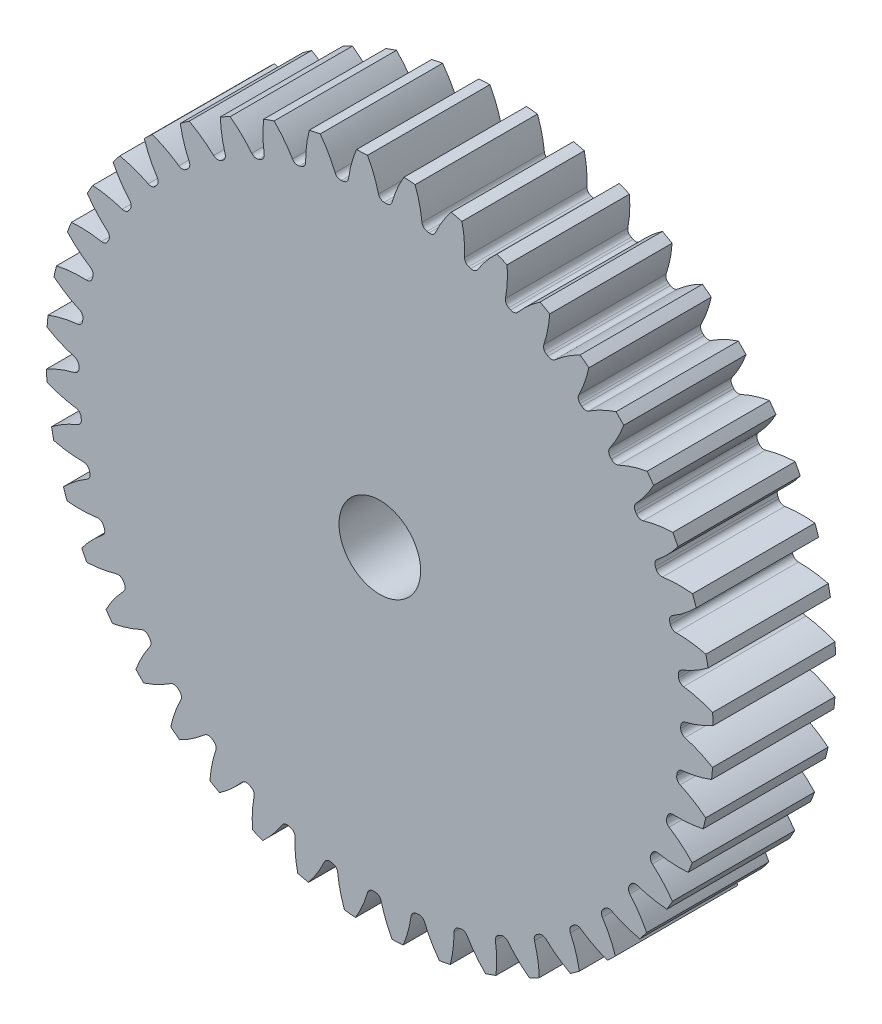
SolidWorks part; units mm, degrees
ref_plane "Front" through (0, 0, 0) normal (0, 0, 1) x (1, 0, 0)
ref_plane "Top" through (0, 0, 0) normal (0, 1, 0) x (1, 0, 0)
ref_plane "Right" through (0, 0, 0) normal (1, 0, 0) x (0, 0, -1)
sketch "Sketch3" plane through (0, 0, 0) normal (0, 0, 1) x (1, 0, 0)
  circle A0 centre (0, 0) radius 259.6444
  dimension "od" = 519.2889
extrude "gearBody" add sketch "Sketch3" along normal blind 95.25
sketch "Sketch2" plane through (0, 0, 0) normal (0, 0, 1) x (1, 0, 0)
  line L0 (0, 0) -> (215.613, 89.3098) construction
  line L1 (259.1306, -18.9688) -> (0, 0) construction
  line L2 (0, 0) -> (36.3143, 0) construction
  line L3 (248.317, 4.3752) -> (248, -13.2845) construction
  line L5 (248.1585, -4.4547) -> (0, 0) construction
  line L7 (0, 0) -> (233.3779, 0) construction
  arc A0 (233.3779, 0.047) -> (233.2258, -8.423) centre (0, 0) ccw construction
  arc A1 (259.4684, 9.5593) -> (258.9582, -18.8655) centre (0, 0) ccw construction
  arc A2 (248.317, 4.3752) -> (248, -13.2845) centre (0, 0) ccw construction
  arc A3 (234.1903, -5.0342) -> (234.2201, -3.3742) centre (0, 0) ccw
  arc A4 (259.1306, -18.9688) -> (237.5096, -9.5473) centre (212.2688, -96.9907) ccw
  arc A5 (259.1306, -18.9688) -> (259.6444, 9.6563) centre (0, 0) ccw
  arc A6 (259.6444, 9.6563) -> (237.6993, 1.0169) centre (215.613, 89.3098) cw
  arc A7 (234.2201, -3.3742) -> (237.6993, 1.0169) centre (238.8142, -3.4404) cw
  arc A8 (237.5096, -9.5473) -> (234.1903, -5.0342) centre (238.7839, -5.133) cw
  point P6 (259.6444, 9.6563)
  point P22 (259.1306, -18.9688)
  dimension "baseDia" = 466.7558
  dimension "od" = 519.2889
  dimension "pd" = 496.7111
  dimension "rd" = 468.4889
  dimension "rFillet" = 4.5946
  dimension "pointX" = 259.6444
  dimension "pointY" = 9.6563
  dimension "CTT" = 17.6597
  dimension "flankCenterAngle" = 22.5
extrude "toothCut" cut sketch "Sketch2" along normal through all
pattern_circular "CirPattern1" count 44 over 360 about axis through (0, 0, 0) along (0, 0, 1) of "toothCut"
sketch "hub1Dia" plane through (0, 0, 0) normal (0, 0, -1) x (-1, 0, 0)
  circle A0 centre (0, 0) radius 12.7
  dimension "hub1Dia" = 25.4
sketch "hub2Dia" plane through (0, 0, 95.25) normal (0, 0, 1) x (1, 0, 0)
  circle A0 centre (0, 0) radius 12.7
  dimension "hub2dia" = 25.4
sketch "boreDia" plane through (0, 0, 0) normal (0, 0, 1) x (1, 0, 0)
  circle A0 centre (0, 0) radius 31.75
  dimension "boreDia" = 63.5
extrude "bore" cut sketch "boreDia" against normal mid plane 25400
